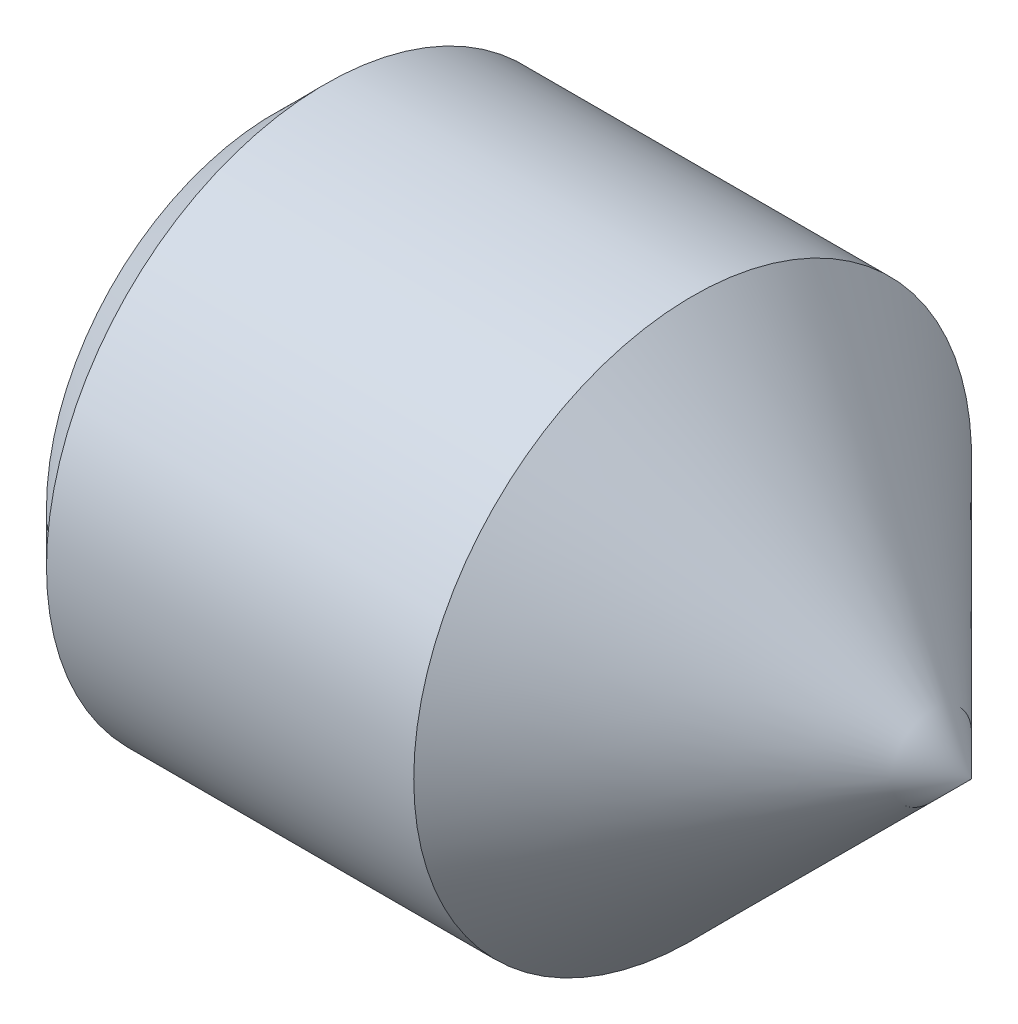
SolidWorks part; units mm, degrees
revolve "BaseBody" add sketch "BodySke" angle 360 about L5
sketch "BodySke" plane through (0, 0, 0) normal (0, 0, 1) x (1, 0, 0)
  line L0 (0, 0) -> (0, 5.1867)
  line L1 (0, 5.1867) -> (1.1633, 6.35)
  line L2 (1.1633, 6.35) -> (9.525, 6.35)
  line L3 (9.525, 6.35) -> (15.875, 0)
  line L4 (15.875, 0) -> (0, 0)
  line L5 (-12.7, 0) -> (88.9, 0) construction
  line L6 (9.525, -6.35) -> (15.875, 0) construction
  line L7 (0.9766, 15.875) -> (0.9766, -3.175) construction
  line L8 (0, -5.1867) -> (1.1633, -6.35) construction
ref_plane "Plane1" through (0, 0, 0) normal (0, 0, 1) x (1, 0, 0)
ref_plane "Plane2" through (0, 0, 0) normal (0, 1, 0) x (1, 0, 0)
ref_plane "Plane3" through (0, 0, 0) normal (1, 0, 0) x (0, 0, -1)
sketch "Sketch2" plane through (0, 0, 0) normal (-1, 0, 0) x (0, 0, 1)
  line L0 (1.8331, 3.175) -> (-1.8331, 3.175)
  line L1 (-1.8331, 3.175) -> (-3.6662, 0)
  line L2 (1.8331, 3.175) -> (3.6662, 0)
  line L3 (1.8331, -3.175) -> (3.6662, 0)
  line L4 (1.8331, -3.175) -> (-1.8331, -3.175)
  line L5 (-1.8331, -3.175) -> (-3.6662, 0)
extrude "Hex" cut sketch "Sketch2" against normal blind 6.35
sketch "Sketch4" plane through (0, 4.7709, -0.5249) normal (-1, 0, 0) x (0, 0, 1)
  line L0 (0.5249, -4.7709) -> (4.3095, -4.7709)
  line L1 (0.5249, -4.7709) -> (6.6732, -1.2211) construction
  line L2 (0.5249, -4.7709) -> (2.4172, -1.4933)
  line L3 (3.6483, -3.9647) -> (4.1478, -3.6764)
  line L4 (2.7847, -2.4689) -> (3.2842, -2.1806)
  arc A0 (3.6483, -3.9647) -> (2.7847, -2.4689) centre (0.5249, -4.7709) ccw
  arc A1 (4.3095, -4.7709) -> (4.1478, -3.6764) centre (0.5249, -4.7709) ccw
  arc A2 (2.4172, -1.4933) -> (3.2842, -2.1806) centre (0.5249, -4.7709) cw
  circle A3 centre (0.5249, -4.7709) radius 3.2258 construction
  circle A4 centre (0.5249, -4.7709) radius 3.7846 construction
extrude "Spline" [suppressed] cut sketch "Sketch4" against normal blind 6.35
pattern_circular "CirPattern1" [suppressed] count 6 every 60 about axis through (-12.7, 0, 0) along (1, 0, 0)
sketch "ThdSchSke" plane through (0, 0, 0) normal (0, 0, 1) x (1, 0, 0)
  line L0 (1.1633, -5.1867) -> (0.3488, -6.35)
  line L1 (1.1633, -5.1867) -> (1.9779, -6.35)
  line L2 (1.9779, -6.35) -> (1.9779, -7.9375)
  line L3 (-3.175, 0) -> (5.1513, 0) construction
  line L4 (1.1633, 6.35) -> (1.1633, -6.35) construction
  line L5 (1.9779, -7.9375) -> (0.3488, -7.9375)
  line L6 (0.3488, -7.9375) -> (0.3488, -6.35)
revolve "ThreadSchematic" [suppressed] cut sketch "ThdSchSke" angle 360 about L3
pattern_linear "ThdSchPat" [suppressed]
equation "\"D2@Sketch2\" = \"Hex_size@Sketch2\" / 2"
equation "\"D3@Sketch2\" = \"Hex_size@Sketch2\" / 2"
equation "\"Thread_minor@ThreadCosmetic\" = \"Minor_dia@BodySke\""
equation "\"D1@Sketch4\" = \"Spline_a_dim@Sketch4\" / 2"
equation "\"D3@Sketch4\" = \"Spline_p_dim@Sketch4\" / 2"
equation "\"D2@CirPattern1\" = \"Spline_a_dim@Sketch4\""
equation "\"Num_teeth@CirPattern1\" = 360 / \"D2@CirPattern1\""
equation "\"Thread_minor@ThdSchSke\" = \"Thread_minor@ThreadCosmetic\""
equation "\"Diameter@ThdSchSke\" = \"Diameter@BodySke\""
equation "\"Overcut@ThdSchSke\" = \"Diameter@BodySke\" * 1.25"
equation "\"Num_threads@ThdSchPat\" = int( (\"Length@BodySke\" - ( ( ( \"Diameter@BodySke\" - \"Minor_dia@BodySke\" ) * 0.5 ) / tan( \"Drive_ch_ang@BodySke\" * 0.017453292 ) ) - ( ( \"Diameter@BodySke\" * 0.5 ) / tan( \"Con"
equation "\"Advance@ThdSchPat\" = (\"Length@BodySke\" - ( ( ( \"Diameter@BodySke\" - \"Minor_dia@BodySke\" ) * 0.5 ) / tan( \"Drive_ch_ang@BodySke\" * 0.017453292 ) ) - ( ( \"Diameter@BodySke\" * 0.5 ) / tan( \"Cone_ang@Bod"
equation "' \"Num_threads@ThdSchPat\" = \"Num_threads@ThdSchPat\" - sgn( \"Num_threads@ThdSchPat\" - 1) '---chamfered tips only---"
